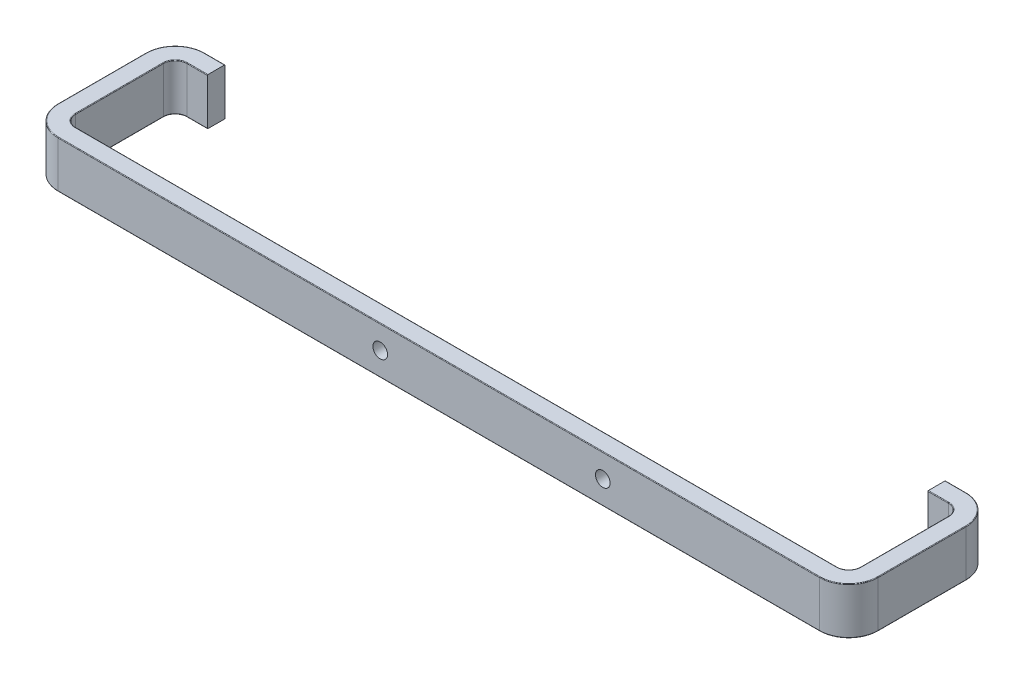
SolidWorks part; units mm, degrees
ref_plane "Plan de face" through (0, 0, 0) normal (0, 0, 1) x (1, 0, 0)
ref_plane "Plan de dessus" through (0, 0, 0) normal (0, 1, 0) x (1, 0, 0)
ref_plane "Plan de droite" through (0, 0, 0) normal (1, 0, 0) x (0, 0, -1)
ref_plane "Plan1" through (0, -20, 0) normal (0, -1, 0) x (1, 0, 0)
sketch "Esquisse1" plane through (0, -20, 0) normal (0, -1, 0) x (1, 0, 0)
  line L0 (-350, -125) -> (350, -125)
  line L1 (350, -125) -> (350, 0)
  line L2 (350, 0) -> (-350, 0)
  line L3 (-350, 0) -> (-350, -125)
extrude "Boss.-Extru.1" add sketch "Esquisse1" against normal blind 40
sketch "Esquisse2" plane through (0, 20, 0) normal (0, 1, 0) x (-1, 0, 0)
  line L0 (-307.5, -125) -> (307.5, -125)
  line L1 (307.5, -125) -> (307.5, -110)
  line L2 (307.5, -110) -> (335, -110)
  line L3 (335, -110) -> (335, -15)
  line L4 (335, -15) -> (-335, -15)
  line L5 (-335, -15) -> (-335, -110)
  line L6 (-335, -110) -> (-307.5, -110)
  line L7 (-307.5, -110) -> (-307.5, -125)
extrude "Enlèv. mat.-Extru.1" cut sketch "Esquisse2" against normal through all
hole_wizard "Diamètre du perçage Ø12.5 (12.5)1" positions "Esquisse4" profile "Esquisse3" hole size "Ø12.5" standard "Ansi Metric"
sketch "Esquisse4" plane through (0, 0, 0) normal (0, 0, 1) x (1, 0, 0)
  point P0 (140, 0)
  point P1 (-50, 0)
sketch "Esquisse3" plane through (140, 0, 0) normal (1, 0, 0) x (0, -1, 0)
  line L0 (0, 0) -> (0, 125)
  line L1 (0, 125) -> (6.25, 125)
  line L2 (6.25, 125) -> (6.25, 0)
  line L5 (6.25, 0) -> (0, 0)
  line L11 (0, -6.35) -> (0, 107.95) construction
  dimension "Diamètre du perçage jusqu'au prochain" = 12.5
  dimension "Profondeur du perçage jusqu'au prochain" = 125
fillet "Congé1" radius 10 4 edges at (335, 0, -15) (335, 0, -110) (-335, 0, -110) (-335, 0, -15)
fillet "Congé2" radius 25 4 edges at (350, 0, 0) (-350, 0, 0) (350, 0, -125) (-350, 0, -125)
fillet "Congé3" radius 0.5 36 edges at (316.25, -20, -110) (332.0711, -20, -107.0711) (-316.25, -20, -110) (335, -20, -62.5) (-332.0711, -20, -107.0711) (332.0711, -20, -17.9289) (-335, -20, -62.5) (0, -20, -15) (-332.0711, -20, -17.9289) (-316.25, 20, -125) (-342.6777, 20, -117.6777) (-350, 20, -62.5) (-342.6777, 20, -7.3223) (0, 20, 0) (342.6777, 20, -7.3223) (350, 20, -62.5) (342.6777, 20, -117.6777) (316.25, 20, -125) (316.25, -20, -125) (342.6777, -20, -117.6777) (350, -20, -62.5) (342.6777, -20, -7.3223) (0, -20, 0) (-342.6777, -20, -7.3223) (-350, -20, -62.5) (-316.25, -20, -125) (-342.6777, -20, -117.6777) (-316.25, 20, -110) (-332.0711, 20, -107.0711) (-335, 20, -62.5) (-332.0711, 20, -17.9289) (0, 20, -15) (332.0711, 20, -17.9289) (335, 20, -62.5) (332.0711, 20, -107.0711) (316.25, 20, -110)
sketch "Esquisse5" plane through (0, 0, 0) normal (0, 0, 1) x (1, 0, 0)
  line L0 (305.96, -19.5) -> (305.96, 19.5)
  line L1 (-325, -19.5) -> (325, -19.5) construction
  line L2 (325, 19.5) -> (-325, 19.5) construction
  line L3 (350, 19.5) -> (350, -19.5) construction
  line L4 (305.96, 0) -> (260.0595, 0)
  point P6 (305.96, 0)
  dimension "D1" = 44.04
